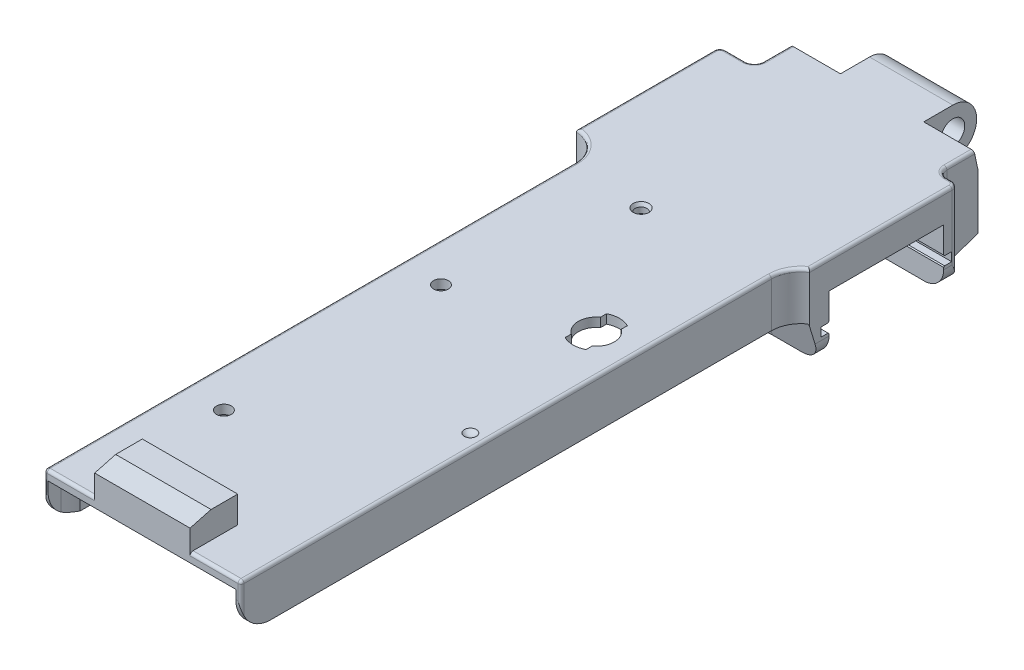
SolidWorks part; units mm, degrees
ref_plane "Спереди" through (0, 0, 0) normal (0, 0, 1) x (1, 0, 0)
ref_plane "Сверху" through (0, 0, 0) normal (0, 1, 0) x (1, 0, 0)
ref_plane "Справа" through (0, 0, 0) normal (1, 0, 0) x (0, 0, -1)
sketch "Эскиз1" plane through (0, 0, 0) normal (1, 0, 0) x (0, 0, -1)
  line L0 (0, 6.35) -> (-192.024, 6.35)
  line L1 (-204.724, 6.35) -> (-204.724, 1.5875)
  line L2 (-196.7865, -6.35) -> (-84.1697, -6.35)
  line L3 (-84.1697, -6.35) -> (-80.9625, -16.8402)
  line L4 (-80.9625, -16.8402) -> (-51.7144, -16.8402)
  line L5 (-51.7144, -16.8402) -> (-51.7144, -11.1252)
  line L6 (-51.7144, -1.2954) -> (-21.1836, -1.2954)
  line L7 (-21.1836, -1.2954) -> (-21.1836, -8.2804)
  line L8 (-21.1836, -16.8402) -> (-17.3736, -16.8402)
  line L9 (-17.3736, -16.8402) -> (-6.7056, -13.1669)
  line L10 (-6.7056, -6.35) -> (0, -6.35)
  line L11 (-51.9684, -10.8712) -> (-53.848, -10.8712)
  line L12 (-19.05, -8.5344) -> (-20.9296, -8.5344)
  line L13 (-19.05, -8.5344) -> (-19.05, -10.8712)
  line L14 (-19.05, -10.8712) -> (-20.9296, -10.8712)
  line L15 (-53.848, -8.5344) -> (-53.848, -10.8712)
  line L16 (-51.9684, -8.5344) -> (-53.848, -8.5344)
  line L17 (-51.7144, -8.2804) -> (-51.7144, -1.2954)
  line L18 (-21.1836, -11.1252) -> (-21.1836, -16.8402)
  line L19 (-36.449, -14.9722) -> (-36.449, 0.8856) construction
  line L20 (-6.7056, -13.1669) -> (-6.7056, -6.35)
  line L21 (-51.7144, -11.1252) -> (-51.9684, -10.8712)
  line L22 (-51.7144, -8.2804) -> (-51.9684, -8.5344)
  line L23 (-20.9296, -10.8712) -> (-21.1836, -11.1252)
  line L24 (-20.9296, -8.5344) -> (-21.1836, -8.2804)
  line L25 (-204.724, 6.35) -> (-204.724, 11.9634)
  line L26 (-204.724, 11.9634) -> (-199.1311, 13.462)
  line L27 (-199.1311, 13.462) -> (-192.024, 13.462)
  line L28 (-192.024, 13.462) -> (-192.024, 6.35)
  circle A0 centre (0, 0) radius 3.175
  arc A1 (0, -6.35) -> (0, 6.35) centre (0, 0) ccw
  arc A2 (-204.724, 1.5875) -> (-196.7865, -6.35) centre (-196.7865, 1.5875) ccw
  point P20 (-21.1836, -10.8712)
  point P21 (-51.7144, -10.8712)
  point P22 (-21.1836, -8.5344)
  point P23 (-51.7144, -8.5344)
  dimension "D1" = 6.35
  dimension "D16" = 7.9375
  dimension "D2" = 6.35
  dimension "D3" = 204.724
  dimension "D4" = 30.5308
  dimension "D5" = 34.798
  dimension "D6" = 80.9625
  dimension "D7" = 53.848
  dimension "D8" = 19
  dimension "D9" = 107
  dimension "D10" = 23.1902
  dimension "D11" = 6.7056
  dimension "D12" = 3.81
  dimension "D13" = 2.3368
  dimension "D14" = 7.6454
  dimension "D15" = 14.8844
  dimension "D17" = 5.6134
  dimension "D18" = 15
  dimension "D23" = 12.7
  dimension "D24" = 7.112
extrude "Бобышка-Вытянуть1" add sketch "Эскиз1" along normal blind 63.3984
sketch "Эскиз2" plane through (0, 13.462, 0) normal (0, 1, 0) x (1, 0, 0)
  line L0 (63.3984, 6.35) -> (0, 6.35) construction
  line L1 (0, 6.35) -> (22.479, 6.35)
  line L2 (0, 6.35) -> (0, -18.9611)
  line L3 (0, -204.724) -> (8.2359, -204.724)
  line L4 (63.3984, 6.35) -> (63.3984, -18.9611)
  line L5 (0, 0) -> (0, -192.024) construction
  line L6 (63.3984, 0) -> (63.3984, -192.024) construction
  line L7 (63.3984, -204.724) -> (0, -204.724) construction
  line L8 (7.4422, -203.9303) -> (7.4422, -63.5)
  line L9 (59.8424, -203.9303) -> (59.8424, -63.5)
  line L10 (1.5875, -17.3736) -> (6.7881, -17.3736)
  line L11 (9.1694, -14.9924) -> (9.1694, -6.7056)
  line L12 (9.1694, -6.7056) -> (22.479, -6.7056)
  line L13 (22.479, -6.7056) -> (22.479, 6.35)
  line L14 (44.6532, 6.35) -> (44.6532, -6.7056)
  line L15 (44.6532, -6.7056) -> (58.0644, -6.7056)
  line L16 (58.0644, -6.7056) -> (58.0644, -14.9924)
  line L17 (60.4456, -17.3736) -> (61.8109, -17.3736)
  line L18 (67.7799, -63.5) -> (-0.4953, -63.5) construction
  line L19 (59.0486, -204.724) -> (63.3984, -204.724)
  line L20 (63.3984, -56.8814) -> (63.3984, -204.724)
  line L21 (0, -55.578) -> (0, -204.724)
  line L22 (44.6532, 6.35) -> (63.3984, 6.35)
  line L23 (63.3984, -21.1836) -> (0, -21.1836) construction
  line L24 (49.4284, -80.5912) -> (49.4284, -118.8496) construction
  line L25 (39.6327, -99.7204) -> (61.4714, -99.7204) construction
  line L26 (46.6598, -94.2182) -> (46.6598, -95.8375)
  line L27 (52.197, -94.2182) -> (52.197, -95.8375)
  line L28 (46.6598, -103.6033) -> (46.6598, -105.2226)
  line L29 (52.197, -103.6033) -> (52.197, -105.2226)
  arc A0 (8.2359, -204.724) -> (7.4422, -203.9303) centre (8.2359, -203.9303) cw
  arc A1 (59.0486, -204.724) -> (59.8424, -203.9303) centre (59.0486, -203.9303) ccw
  arc A2 (1.5875, -17.3736) -> (0, -18.9611) centre (1.5875, -18.9611) ccw
  arc A3 (61.8109, -17.3736) -> (63.3984, -18.9611) centre (61.8109, -18.9611) cw
  arc A4 (7.4422, -63.5) -> (0, -55.578) centre (-0.4953, -63.5) ccw
  arc A5 (59.8424, -63.5) -> (63.3984, -56.8814) centre (67.7799, -63.5) cw
  arc A6 (58.0644, -14.9924) -> (60.4456, -17.3736) centre (60.4456, -14.9924) ccw
  arc A7 (6.7881, -17.3736) -> (9.1694, -14.9924) centre (6.7881, -14.9924) ccw
  arc A8 (46.6598, -95.8375) -> (46.6598, -103.6033) centre (49.4284, -99.7204) ccw
  arc A9 (52.197, -94.2182) -> (46.6598, -94.2182) centre (49.4284, -99.7204) ccw
  arc A10 (46.6598, -105.2226) -> (52.197, -105.2226) centre (49.4284, -99.7204) ccw
  arc A11 (52.197, -103.6033) -> (52.197, -95.8375) centre (49.4284, -99.7204) ccw
  circle A12 centre (17.9578, -167.4114) radius 1.9685
  circle A13 centre (17.9578, -109.601) radius 1.9685
  circle A14 centre (26.8732, -65.2272) radius 1.5748
  dimension "D1" = 0.7937
  dimension "D2" = 7.9375
  dimension "D6" = 1.5875
  dimension "D13" = 2.3813
  dimension "D14" = 4.7688
  dimension "D15" = 6.1595
  dimension "D21" = 3.937
  dimension "D23" = 32.9692
  dimension "D26" = 3.1496
  dimension "D3" = 63.5
  dimension "D4" = 3.556
  dimension "D5" = 52.4002
  dimension "D7" = 1.778
  dimension "D8" = 22.1742
  dimension "D9" = 15.0368
  dimension "D10" = 48.895
  dimension "D11" = 6.7056
  dimension "D12" = 3.81
  dimension "D16" = 5.5372
  dimension "D17" = 10.414
  dimension "D18" = 99.7204
  dimension "D19" = 57.8104
  dimension "D20" = 41.8846
  dimension "D22" = 109.601
  dimension "D27" = 65.2272
extrude "Вырез-Вытянуть1" cut sketch "Эскиз2" against normal through all
sketch "Эскиз3" plane through (0, -16.8402, 0) normal (0, -1, 0) x (1, 0, 0)
  line L0 (22.479, -6.35) -> (44.6532, -6.35) construction
  line L1 (10.6934, -6.35) -> (56.7944, -6.35)
  line L2 (10.6934, -6.35) -> (10.6934, 7.8486)
  line L3 (20.2184, 17.3736) -> (47.2694, 17.3736)
  line L4 (56.7944, -6.35) -> (56.7944, 7.8486)
  line L5 (63.3984, 21.1836) -> (0, 21.1836) construction
  line L6 (59.8424, 84.1697) -> (59.8424, 196.7865) construction
  arc A0 (10.6934, 7.8486) -> (20.2184, 17.3736) centre (20.2184, 7.8486) cw
  arc A1 (47.2694, 17.3736) -> (56.7944, 7.8486) centre (47.2694, 7.8486) cw
  dimension "D4" = 9.525
  dimension "D1" = 46.101
  dimension "D2" = 3.81
  dimension "D3" = 49.149
extrude "Вырез-Вытянуть2" cut sketch "Эскиз3" against normal up to surface (10.4902 mm away)
sketch "Эскиз4" plane through (0, 0, 0) normal (-1, 0, 0) x (0, 0, 1)
  line L0 (6.7056, 1.4506) -> (6.7056, 6.35)
  line L1 (6.7056, 6.35) -> (7.747, 6.35)
  line L2 (7.747, 6.35) -> (6.7056, 1.4506)
  line L3 (6.7056, 6.35) -> (14.9924, 6.35) construction
  line L4 (6.7056, -13.1669) -> (6.7056, 6.35) construction
  dimension "D1" = 12
  dimension "D2" = 7.747
extrude "Вырез-Вытянуть3" cut sketch "Эскиз4" against normal up to surface (22.479 mm away)
sketch "Эскиз5" plane through (63.3984, 0, 0) normal (1, 0, 0) x (0, 0, -1)
  line L0 (-6.7056, 1.4506) -> (-6.7056, 6.35)
  line L1 (-6.7056, 6.35) -> (-7.747, 6.35)
  line L2 (-7.747, 6.35) -> (-6.7056, 1.4506)
  line L3 (-6.7056, -13.1669) -> (-6.7056, 6.35) construction
  line L4 (-14.9924, 6.35) -> (-6.7056, 6.35) construction
  line L5 (-7.747, 6.35) -> (-6.7056, 1.4506) construction
extrude "Вырез-Вытянуть4" cut sketch "Эскиз5" against normal up to surface (18.7452 mm away)
sketch "Эскиз6" plane through (0, 0, 192.024) normal (0, 0, -1) x (-1, 0, 0)
  line L0 (-59.8424, 13.462) -> (-7.4422, 13.462) construction
  line L1 (-46.2661, 13.462) -> (-59.8424, 13.462)
  line L2 (-46.2661, 13.462) -> (-46.2661, 6.35)
  line L3 (-46.2661, 6.35) -> (-59.8424, 6.35)
  line L4 (-59.8424, 13.462) -> (-59.8424, 6.35)
  line L5 (-59.8424, 6.35) -> (-7.4422, 6.35) construction
  line L6 (-7.4422, 13.462) -> (-20.8661, 13.462)
  line L7 (-7.4422, 13.462) -> (-7.4422, 6.35)
  line L8 (-7.4422, 6.35) -> (-20.8661, 6.35)
  line L9 (-20.8661, 13.462) -> (-20.8661, 6.35)
  line L10 (-33.5661, 18.5353) -> (-33.5661, 2.7632) construction
  line L13 (-22.479, -6.35) -> (-22.479, 1.4506) construction
  line L14 (-44.6532, -6.35) -> (-44.6532, 1.4506) construction
  dimension "D1" = 25.4
extrude "Вырез-Вытянуть5" cut sketch "Эскиз6" against normal through all
sketch "Эскиз7" plane through (0, -16.8402, 0) normal (0, -1, 0) x (-1, 0, 0)
  line L0 (-55.6006, -178.5938) -> (-55.6006, -102.0692)
  line L1 (-46.0756, -54.61) -> (-21.1836, -54.61)
  line L2 (-11.6586, -64.135) -> (-11.6586, -194.071)
  line L4 (-59.8424, -84.1697) -> (-59.8424, -196.7865) construction
  line L5 (-58.4454, -201.2156) -> (-58.4454, -204.724)
  line L6 (-58.4454, -204.724) -> (-8.4328, -204.724)
  line L7 (-8.4328, -204.724) -> (-8.4328, -201.2156)
  line L8 (-59.0486, -204.724) -> (-8.2359, -204.724) construction
  line L9 (-53.1876, -190.9247) -> (-53.1876, -186.0414)
  line L10 (-55.6006, -97.3716) -> (-55.6006, -64.135)
  arc A0 (-55.6006, -64.135) -> (-46.0756, -54.61) centre (-46.0756, -64.135) cw
  arc A1 (-21.1836, -54.61) -> (-11.6586, -64.135) centre (-21.1836, -64.135) cw
  arc A2 (-55.6006, -102.0692) -> (-55.6006, -97.3716) centre (-49.4284, -99.7204) cw
  arc A3 (-52.197, -95.8375) -> (-52.197, -103.6033) centre (-49.4284, -99.7204) ccw construction
  arc A4 (-8.4328, -201.2156) -> (-11.6586, -194.071) centre (-17.9578, -201.2156) ccw
  arc A5 (-55.6006, -178.5938) -> (-53.7908, -184.1795) centre (-46.0756, -178.5938) ccw
  arc A6 (-58.4454, -201.2156) -> (-54.502, -193.4974) centre (-48.9204, -201.2156) cw
  arc A7 (-53.7908, -184.1795) -> (-53.1876, -186.0414) centre (-56.3626, -186.0414) cw
  arc A8 (-54.502, -193.4974) -> (-53.1876, -190.9247) centre (-56.3626, -190.9247) ccw
  dimension "D1" = 9.525
  dimension "D2" = 6.604
  dimension "D11" = 3.175
  dimension "D3" = 54.61
  dimension "D4" = 43.942
  dimension "D5" = 4.2418
  dimension "D6" = 41.8846
  dimension "D7" = 201.2156
  dimension "D8" = 6.6548
  dimension "D9" = 178.5938
  dimension "D10" = 1.397
extrude "Вырез-Вытянуть6" cut sketch "Эскиз7" against normal offset from surface (20.7772 mm away) 2.413
sketch "Эскиз8" plane through (0, -16.8402, 0) normal (0, -1, 0) x (1, 0, 0)
  line L0 (58.4454, 189.7062) -> (58.4454, 64.135)
  line L1 (48.9204, 54.61) -> (22.479, 54.61)
  line L2 (22.479, 54.61) -> (22.479, 65.4844)
  line L3 (22.479, 65.4844) -> (18.3134, 65.4844)
  line L4 (8.7884, 75.0094) -> (8.7884, 189.7062)
  line L5 (21.1836, 54.61) -> (46.0756, 54.61) construction
  line L6 (59.8424, 84.1697) -> (59.8424, 196.7865) construction
  line L7 (22.479, 6.7056) -> (22.479, 0) construction
  line L8 (9.3726, 192.9907) -> (9.3726, 197.0901)
  line L9 (8.4328, 201.2156) -> (8.4328, 204.724)
  line L10 (8.4328, 204.724) -> (58.4454, 204.724)
  line L11 (58.4454, 204.724) -> (58.4454, 201.2156)
  line L12 (58.2676, 199.3838) -> (58.2676, 191.538)
  line L13 (8.4328, 204.724) -> (58.4454, 204.724) construction
  line L14 (58.4454, 204.724) -> (58.4454, 201.2156) construction
  line L15 (8.4328, 201.2156) -> (8.4328, 204.724) construction
  arc A0 (18.3134, 65.4844) -> (8.7884, 75.0094) centre (18.3134, 75.0094) cw
  arc A1 (58.4454, 64.135) -> (48.9204, 54.61) centre (48.9204, 64.135) cw
  arc A2 (58.4454, 189.7062) -> (58.2676, 191.538) centre (48.9204, 189.7062) ccw
  arc A3 (58.4454, 201.2156) -> (58.2676, 199.3838) centre (48.9204, 201.2156) cw
  arc A4 (8.7884, 189.7062) -> (9.3726, 192.9907) centre (18.3134, 189.7062) cw
  arc A5 (9.3726, 197.0901) -> (8.4328, 201.2156) centre (17.9578, 201.2156) cw
  arc A8 (54.502, 193.4974) -> (58.4454, 201.2156) centre (48.9204, 201.2156) ccw construction
  arc A9 (8.4328, 201.2156) -> (11.6586, 194.071) centre (17.9578, 201.2156) ccw construction
  dimension "D1" = 9.525
  dimension "D2" = 75.0094
  dimension "D3" = 1.397
  dimension "D4" = 49.657
  dimension "D5" = 1.5748
  dimension "D6" = 48.895
  dimension "D7" = 189.7062
extrude "Вырез-Вытянуть7" cut sketch "Эскиз8" against normal offset from surface (13.6906 mm away) 9.4996
sketch "Эскиз9" plane through (0, 6.35, 0) normal (0, -1, 0) x (1, 0, 0)
  line L0 (55.6006, 51.7144) -> (27.0256, 51.7144) construction
  line L3 (63.3984, 51.7144) -> (0, 51.7144) construction
  line L4 (11.6586, 64.135) -> (11.6586, 194.071) construction
  line L5 (55.6006, 97.3716) -> (55.6006, 64.135) construction
  circle A0 centre (41.3131, 60.3001) radius 16.6687
  dimension "D1" = 33.3375
  dimension "D2" = 43.942
  dimension "D3" = 28.575
extrude "Вырез-Вытянуть8" cut sketch "Эскиз9" against normal blind 4.953 from offset 12.8524
chamfer "Фаска1" distance 0.889 angle 30 1 edges at (26.8732, 6.35, 63.6524)
sketch "Эскиз10" plane through (63.3984, 0, 0) normal (1, 0, 0) x (0, 0, -1)
  line L0 (-53.848, -16.8402) -> (-57.0552, -6.35)
  line L1 (-80.9625, -16.8402) -> (-84.1697, -6.35) construction
  line L2 (-84.1697, -6.35) -> (-196.7865, -6.35) construction
  line L3 (-56.8814, -16.8402) -> (-51.7144, -16.8402) construction
  dimension "D1" = 53.848
sketch "Эскиз11" plane through (0, -16.8402, 0) normal (0, -1, 0) x (1, 0, 0)
  line L0 (50.4627, 53.848) -> (63.3984, 53.848)
  line L1 (63.3984, 53.848) -> (63.3984, 98.2282)
  line L2 (63.3984, 98.2282) -> (46.7296, 98.2282)
  line L3 (46.7296, 98.2282) -> (46.7297, 54.61)
  line L6 (21.1836, 54.61) -> (48.9204, 54.61) construction
  arc A0 (50.4627, 53.848) -> (46.7297, 54.61) centre (50.4627, 63.373) cw
  dimension "D1" = 9.525
  dimension "D2" = 16.6687
sweep "Вырез-По траектории1" cut profiles "Эскиз11" path "Эскиз10"
sketch "Эскиз12" plane through (0, 0, 204.724) normal (0, 0, 1) x (1, 0, 0)
  line L0 (63.3984, -11.6808) -> (63.3984, -16.8402)
  line L1 (63.3984, -16.8402) -> (58.239, -16.8402)
  line L2 (63.3984, -16.8402) -> (0, -16.8402) construction
  line L3 (5.1594, -16.8402) -> (0, -16.8402)
  line L4 (0, -16.8402) -> (0, -11.6808)
  line L5 (63.3984, -11.1252) -> (63.3984, -16.8402) construction
  line L6 (0, -11.1252) -> (0, -16.8402) construction
  arc A0 (63.3984, -11.6808) -> (58.239, -16.8402) centre (58.239, -11.6808) cw
  arc A1 (0, -11.6808) -> (5.1594, -16.8402) centre (5.1594, -11.6808) ccw
  dimension "D1" = 5.1594
extrude "Вырез-Вытянуть9" cut sketch "Эскиз12" against normal through all
fillet "Скругление1" radius 0.7937 18 edges at (52.6574, 6.35, 204.724) (59.6099, 6.35, 204.4915) (60.7877, 6.35, 59.7433) (58.0644, 6.35, 11.3697) (58.7619, 6.35, 16.6761) (61.1283, 6.35, 17.3736) (62.9334, 6.35, 17.8386) (9.1694, 6.35, 11.3697) (8.4719, 6.35, 16.6761) (4.1878, 6.35, 17.3736) (0.465, 6.35, 17.8386) (5.2898, 6.35, 58.0653) (14.551, 6.35, 204.724) (7.6747, 6.35, 204.4915) (59.8424, 6.35, 133.7151) (63.3984, 6.35, 37.9212) (0, 6.35, 37.2695) (7.4422, 6.35, 133.7151)
ref_plane "Плоскость1" through (56.0324, 0, 0) normal (1, 0, 0) x (0, 0, -1)
sketch "Эскиз13" plane through (56.0324, 0, 0) normal (1, 0, 0) x (0, 0, -1)
  line L0 (-139.8524, 11.9481) -> (-139.8524, 5.715) construction
  line L1 (-139.8524, 6.35) -> (-138.2649, 6.35)
  line L2 (-203.9303, 6.35) -> (-63.5, 6.35) construction
  line L3 (-139.8524, 5.715) -> (-139.8524, 6.35)
  line L4 (-95.8375, 6.35) -> (-103.6033, 6.35) construction
  arc A0 (-139.8524, 5.715) -> (-138.2649, 6.35) centre (-139.8524, 8.0169) ccw
  point P2 (-99.7204, 6.35)
  dimension "D1" = 0.635
  dimension "D2" = 40.132
  dimension "D3" = 3.175
revolve "Вырез-Повернуть1" cut sketch "Эскиз13" angle 360 about L0
